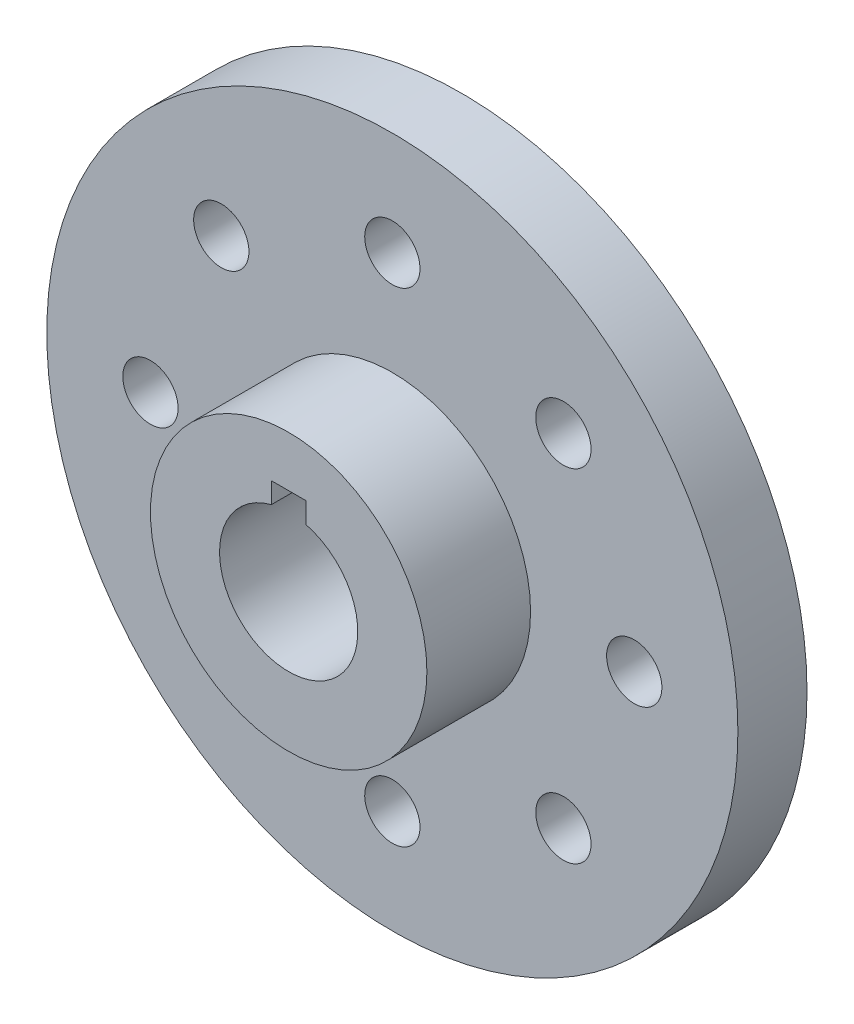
SolidWorks part; units mm, degrees
ref_plane "Front" through (0, 0, 0) normal (0, 0, 1) x (1, 0, 0)
ref_plane "Top" through (0, 0, 0) normal (0, 1, 0) x (1, 0, 0)
ref_plane "Right" through (0, 0, 0) normal (1, 0, 0) x (0, 0, -1)
sketch "Sketch1" plane through (0, 0, 0) normal (1, 0, 0) x (0, 0, -1)
  line L0 (0, 0) -> (71.6266, 0) construction
  line L1 (0, 0) -> (0, 20)
  line L2 (0, 20) -> (15, 20)
  line L3 (15, 20) -> (15, 50)
  line L4 (15, 50) -> (25, 50)
  line L5 (25, 50) -> (25, 0)
  line L6 (25, 0) -> (0, 0)
  dimension "D1" = 40
  dimension "D2" = 100
  dimension "D3" = 10
  dimension "D4" = 15
revolve "Revolve1" add sketch "Sketch1" angle 360 about L0
sketch "Sketch2" plane through (0, 0, 0) normal (0, 0, 1) x (1, 0, 0)
  circle A0 centre (0, 0) radius 10
  dimension "D1" = 20
extrude "Cut-Extrude1" cut sketch "Sketch2" against normal through all
sketch "Sketch3" plane through (0, 0, -15) normal (0, 0, 1) x (1, 0, 0)
  line L0 (0, 0) -> (24.7487, 24.7487) construction
  line L1 (0, 0) -> (50, 0) construction
  circle A0 centre (24.7487, 24.7487) radius 4
  circle A1 centre (0, 0) radius 50 construction
  dimension "D3" = 8
  dimension "D1" = 45
  dimension "D2" = 35
extrude "Cut-Extrude2" cut sketch "Sketch3" against normal through all
pattern_circular "CirPattern1" count 8 over 360
sketch "Sketch4" plane through (0, 0, 0) normal (0, 0, 1) x (1, 0, 0)
  line L0 (0, 0) -> (0, 20) construction
  line L1 (2.5, 9.6825) -> (2.5, 12.6825)
  line L2 (2.5, 12.6825) -> (-2.5, 12.6825)
  line L3 (-2.5, 9.6825) -> (-2.5, 12.6825)
  circle A0 centre (0, 0) radius 20 construction
  circle A1 centre (0, 0) radius 10 construction
  arc A2 (2.5, 9.6825) -> (-2.5, 9.6825) centre (0, 0) ccw
  point P11 (0, 12.6825)
  dimension "D1" = 5
  dimension "D2" = 3
extrude "Cut-Extrude3" cut sketch "Sketch4" against normal through all
